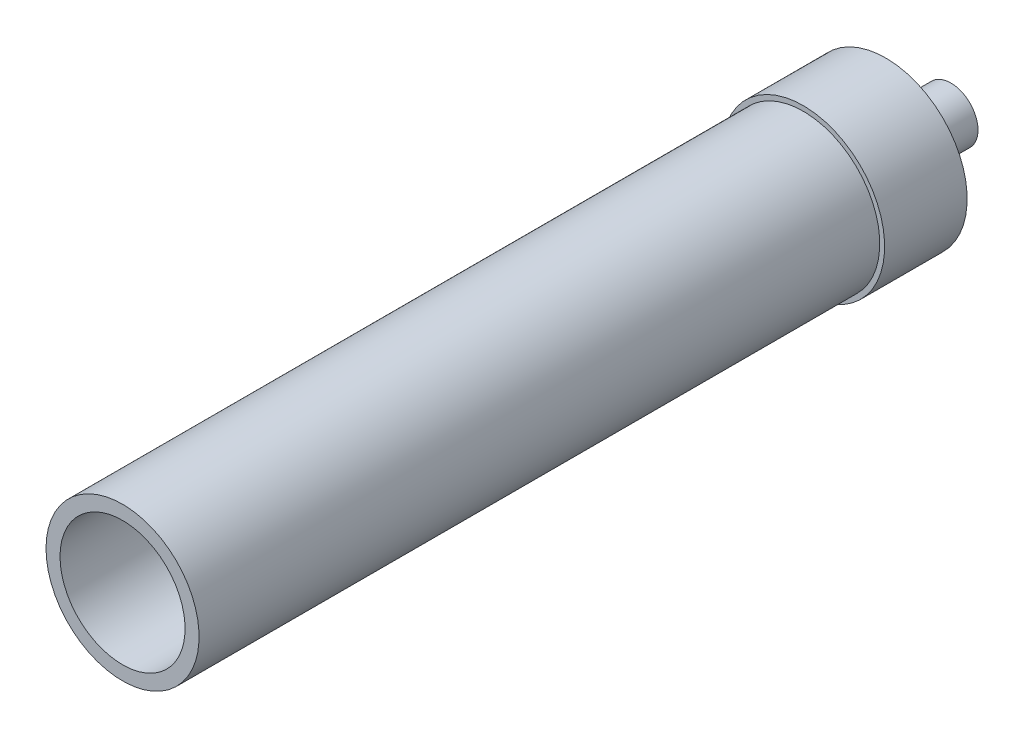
SolidWorks part; units mm, degrees
ref_plane "Front" through (0, 0, 0) normal (0, 0, 1) x (1, 0, 0)
ref_plane "Top" through (0, 0, 0) normal (0, 1, 0) x (1, 0, 0)
ref_plane "Right" through (0, 0, 0) normal (1, 0, 0) x (0, 0, -1)
sketch "Sketch1" plane through (0, 0, 0) normal (0, 0, 1) x (1, 0, 0)
  circle A0 centre (0, 0) radius 8.9535
  circle A1 centre (0, 0) radius 7.3152
  dimension "D1" = 17.907
  dimension "D2" = 14.6304
extrude "Extrude1" add sketch "Sketch1" along normal blind 89.281
sketch "Sketch2" plane through (0, 0, 0) normal (0, 0, 1) x (1, 0, 0)
  circle A0 centre (0, 0) radius 9.525
  dimension "D1" = 19.05
extrude "Extrude2" add sketch "Sketch2" along normal blind 9.652
sketch "Sketch3" plane through (0, 0, 0) normal (0, 0, -1) x (-1, 0, 0)
  circle A0 centre (0, 0) radius 3.175
  dimension "D1" = 6.35
extrude "Extrude3" add sketch "Sketch3" along normal blind 7.62
sketch "Sketch4" plane through (0, 0, 0) normal (0, 0, -1) x (-1, 0, 0)
  circle A0 centre (0, 0) radius 4.445
  dimension "D1" = 8.89
extrude "Extrude4" add sketch "Sketch4" along normal blind 1.27
